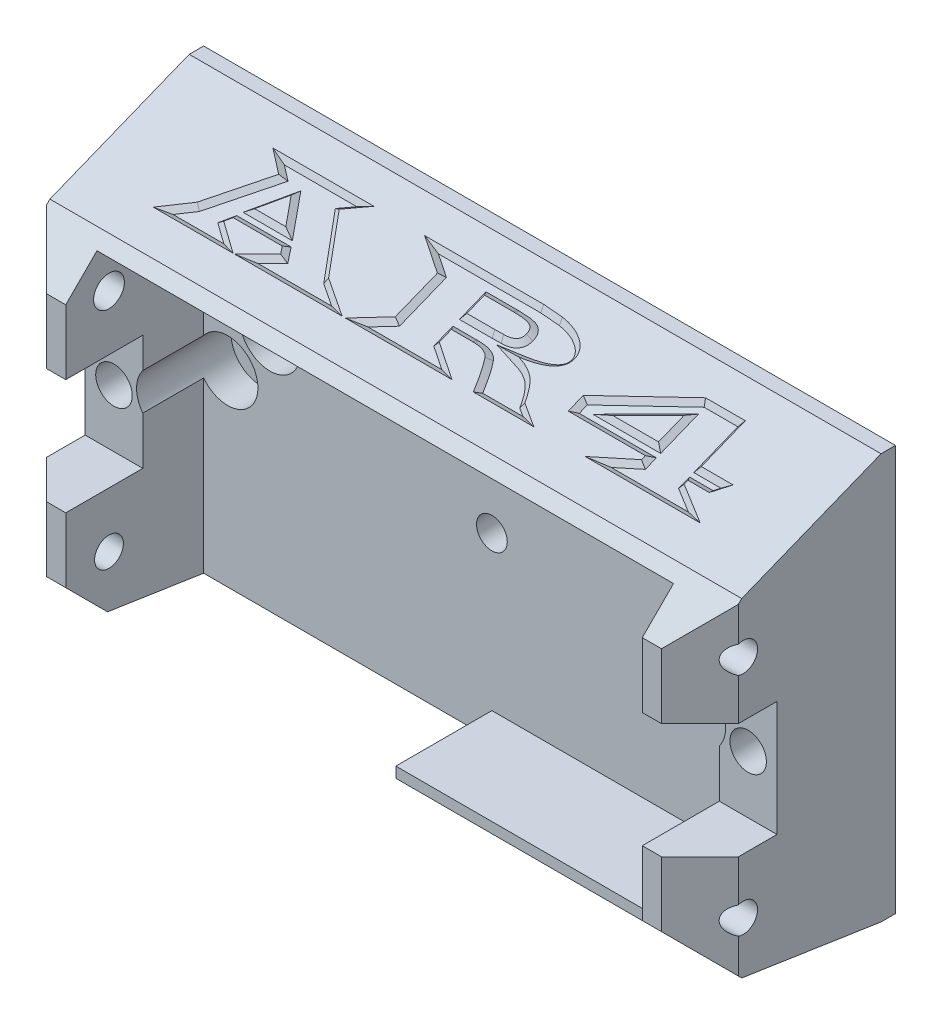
SolidWorks part; units mm, degrees
ref_plane "Front Plane" through (0, 0, 0) normal (0, 0, 1) x (1, 0, 0)
ref_plane "Top Plane" through (0, 0, 0) normal (0, 1, 0) x (1, 0, 0)
ref_plane "Right Plane" through (0, 0, 0) normal (1, 0, 0) x (0, 0, -1)
imported_body "Imported3"
ref_plane "Plane1" through (30, 0, 0) normal (1, 0, 0) x (0, 0, -1)
sketch "Sketch1" plane through (30, 0, 0) normal (1, 0, 0) x (0, 0, -1)
  line L0 (-20.35, 9.85) -> (-6, 9.85)
  line L1 (-6, 9.85) -> (-6, 13.1)
  line L2 (-6, 13.1) -> (-17.1, 13.1)
  line L3 (-17.1, 13.1) -> (-20.35, 9.85)
extrude "Cut-Extrude1" cut sketch "Sketch1" against normal blind 30
sketch "Sketch2" plane through (0, 0, 0) normal (1, 0, 0) x (0, 0, -1)
  line L0 (-20.35, 3.1) -> (-20.35, -8.9)
  line L1 (-20.35, -8.9) -> (-20.35, -19.34)
  line L2 (-20.35, -19.34) -> (-6, -21.5172)
  line L3 (-6, -21.5172) -> (-6, 13.1)
  line L4 (-6, 13.1) -> (-17.1, 13.1)
  line L5 (-17.1, 13.1) -> (-20.35, 9.85)
  line L6 (-20.35, 9.85) -> (-20.35, 3.1)
extrude "Cut-Extrude2" cut sketch "Sketch2" against normal blind 30
sketch "Sketch3" plane through (0, 9.85, 0) normal (0, 1, 0) x (-1, 0, 0)
  line L0 (-30, 20.35) -> (-30, 6)
  line L1 (-30, 6) -> (0, 6)
  line L2 (0, 6) -> (0, 20.35)
  line L3 (0, 20.35) -> (-30, 20.35)
extrude "Cut-Extrude3" cut sketch "Sketch3" against normal blind 6.75
sketch "Sketch4" plane through (0, 3.1, 0) normal (0, 1, 0) x (-1, 0, 0)
  line L0 (0, 20.35) -> (-32, 20.35)
  line L1 (-32, 20.35) -> (-36, 16.35)
  line L2 (-36, 16.35) -> (-36, 12.3321)
  line L3 (-36, 12.3321) -> (-30, 12.3321)
  line L4 (-30, 12.3321) -> (-30, 6)
  line L5 (-30, 6) -> (0, 6)
  line L6 (0, 6) -> (0, 20.35)
extrude "Cut-Extrude4" cut sketch "Sketch4" against normal blind 12
ref_plane "Plane2" through (0, 3.1, 0) normal (0, 1, 0) x (1, 0, 0)
sketch "Sketch5" plane through (0, 3.1, 0) normal (0, 1, 0) x (1, 0, 0)
  line L0 (-30, -12.3321) -> (-36, -12.3321)
  line L1 (-36, -12.3321) -> (-36, -16.35)
  line L2 (-36, -16.35) -> (-32, -20.35)
  line L3 (-32, -20.35) -> (-30, -20.35)
  line L4 (-30, -20.35) -> (-30, -12.3321)
extrude "Cut-Extrude5" cut sketch "Sketch5" against normal blind 12
sketch "Sketch6" plane through (0, 0, 1.5) normal (0, 0, -1) x (-1, 0, 0)
  line L0 (36, -22.2) -> (-36, -22.2)
  line L1 (-36, -22.2) -> (-36, 20)
  line L2 (-36, 20) -> (36, 20)
  line L3 (36, 20) -> (36, -22.2)
extrude "Boss-Extrude1" add sketch "Sketch6" along normal blind 1.5
sketch "Sketch7" plane through (0, -8.9, 0) normal (0, 1, 0) x (-1, 0, 0)
  line L0 (0, 20.35) -> (-30, 20.35)
  line L1 (-30, 20.35) -> (-30, 16)
  line L2 (-30, 16) -> (0, 16)
  line L3 (0, 16) -> (0, 20.35)
extrude "Cut-Extrude6" cut sketch "Sketch7" against normal up to next
sketch "Sketch8" plane through (0, -8.9, 0) normal (0, 1, 0) x (-1, 0, 0)
  line L0 (0, 6) -> (0, 16)
  line L1 (0, 16) -> (-30, 16)
  line L2 (-30, 16) -> (-30, 6)
  line L3 (-30, 6) -> (0, 6)
extrude "Cut-Extrude7" cut sketch "Sketch8" against normal blind 10
sketch "Sketch9" plane through (0, 17.7586, 7.1034) normal (0, 0.9285, 0.3714) x (-1, 0, 0)
  line L0 (-24.7967, -2.8908) -> (-20.6573, -2.8908)
  line L1 (-20.6573, -2.8908) -> (-12.3225, 1.8333)
  line L2 (-12.3225, 1.8333) -> (-12.3225, 3.5315)
  line L3 (-12.3225, 3.5315) -> (-20.3504, 3.5315)
  line L4 (-20.3504, 3.5315) -> (-20.3504, 3.9657)
  line L5 (-20.3504, 3.9657) -> (-16.3712, 6.0016)
  line L6 (-16.3712, 6.0016) -> (-28.3533, 6.0016)
  line L7 (-28.3533, 6.0016) -> (-24.7967, 3.9657)
  line L8 (-24.7967, 3.9657) -> (-24.7967, 3.5315)
  line L9 (-24.7967, 3.5315) -> (-27.0043, 3.5315)
  line L10 (-27.0043, 3.5315) -> (-28.1063, 2.0494)
  line L11 (-28.1063, 2.0494) -> (-24.7967, 2.0494)
  line L12 (-24.7967, 2.0494) -> (-24.7967, -2.8908)
extrude "Cut-Extrude8" cut sketch "Sketch9" against normal blind 0.5 draft 45
sketch "Sketch10" plane through (0, 17.2944, 6.9178) normal (0, 0.9285, 0.3714) x (-1, 0, 0)
  line L0 (-13.794, 2.5494) -> (-20.8504, -1.6947)
  line L1 (-20.8504, -1.6947) -> (-20.8504, 2.5494)
  line L2 (-20.8504, 2.5494) -> (-13.794, 2.5494)
extrude "Boss-Extrude2" add sketch "Sketch10" along normal blind 0.5 draft 45
sketch "Sketch11" plane through (0, 17.7586, 7.1034) normal (0, 0.9285, 0.3714) x (-1, 0, 0)
  line L0 (13.8617, -2.8908) -> (24.3752, -2.8908)
  line L1 (24.3752, -2.8908) -> (22.291, -1.2988)
  line L2 (22.291, -1.2988) -> (25.9499, 3.8943)
  line L3 (25.9499, 3.8943) -> (28.5686, 6.0016)
  line L4 (28.5686, 6.0016) -> (20.2647, 6.0016)
  line L5 (20.2647, 6.0016) -> (22.9472, 4.1529)
  line L6 (22.9472, 4.1529) -> (22.5515, 3.5315)
  line L7 (22.5515, 3.5315) -> (17.4318, 3.5315)
  line L8 (17.4318, 3.5315) -> (17.0285, 4.1529)
  line L9 (17.0285, 4.1529) -> (20.1142, 6.0016)
  line L10 (20.1142, 6.0016) -> (8.9118, 6.0016)
  line L11 (8.9118, 6.0016) -> (12.2735, 3.8943)
  line L12 (12.2735, 3.8943) -> (15.9922, -1.2988)
  line L13 (15.9922, -1.2988) -> (13.8617, -2.8908)
extrude "Cut-Extrude9" cut sketch "Sketch11" against normal blind 0.5 draft 45
sketch "Sketch12" plane through (0, 17.2944, 6.9178) normal (0, 0.9285, 0.3714) x (-1, 0, 0)
  line L0 (17.484, 2.5494) -> (22.609, 2.5494)
  line L1 (22.609, 2.5494) -> (20.1273, -1.2493)
  line L2 (20.1273, -1.2493) -> (17.484, 2.5494)
extrude "Boss-Extrude3" add sketch "Sketch12" along normal blind 0.5 draft 45
sketch "Sketch13" plane through (0, -21.9229, 3.3262) normal (0, -0.9887, 0.15) x (1, 0, 0)
  line L0 (3.9049, 2.1359) -> (6.2298, 2.1359)
  line L1 (6.2298, 2.1359) -> (11.1094, 5.8102)
  line L2 (11.1094, 5.8102) -> (11.1094, 7.131)
  line L3 (11.1094, 7.131) -> (6.4025, 7.131)
  line L4 (6.4025, 7.131) -> (6.4025, 7.4687)
  line L5 (6.4025, 7.4687) -> (8.7349, 9.0522)
  line L6 (8.7349, 9.0522) -> (1.8561, 9.0522)
  line L7 (1.8561, 9.0522) -> (3.9049, 7.4687)
  line L8 (3.9049, 7.4687) -> (3.9049, 7.131)
  line L9 (3.9049, 7.131) -> (2.6321, 7.131)
  line L10 (2.6321, 7.131) -> (1.9987, 5.9783)
  line L11 (1.9987, 5.9783) -> (3.9049, 5.9783)
  line L12 (3.9049, 5.9783) -> (3.9049, 2.1359)
extrude "Cut-Extrude10" cut sketch "Sketch13" against normal blind 0.5 draft 45
ref_plane "Plane3" through (0, -21.9229, 3.3262) normal (0, -0.9887, 0.15) x (1, 0, 0)
sketch "Sketch14" plane through (0, -21.9229, 3.3262) normal (0, -0.9887, 0.15) x (1, 0, 0)
  line L0 (9.1912, 5.9783) -> (6.4025, 5.9783)
  line L1 (6.4025, 5.9783) -> (6.4025, 3.7539)
  line L2 (6.4025, 3.7539) -> (9.1912, 5.9783)
extrude "Boss-Extrude4" add sketch "Sketch14" against normal up to next draft 45
sketch "Sketch15" plane through (0, -21.9229, 3.3262) normal (0, -0.9887, 0.15) x (1, 0, 0)
  line L0 (25.883, 2.1359) -> (31.9393, 2.1359)
  line L1 (31.9393, 2.1359) -> (30.7385, 3.3741)
  line L2 (30.7385, 3.3741) -> (32.8474, 7.4132)
  line L3 (32.8474, 7.4132) -> (34.3558, 9.0522)
  line L4 (34.3558, 9.0522) -> (29.5723, 9.0522)
  line L5 (29.5723, 9.0522) -> (31.1183, 7.6143)
  line L6 (31.1183, 7.6143) -> (30.8886, 7.131)
  line L7 (30.8886, 7.131) -> (27.9393, 7.131)
  line L8 (27.9393, 7.131) -> (27.7066, 7.6143)
  line L9 (27.7066, 7.6143) -> (29.4853, 9.0522)
  line L10 (29.4853, 9.0522) -> (23.0312, 9.0522)
  line L11 (23.0312, 9.0522) -> (24.9674, 7.4132)
  line L12 (24.9674, 7.4132) -> (27.1108, 3.3741)
  line L13 (27.1108, 3.3741) -> (25.883, 2.1359)
extrude "Cut-Extrude11" cut sketch "Sketch15" against normal blind 0.5 draft 45
sketch "Sketch16" plane through (0, -21.4286, 3.2512) normal (0, -0.9887, 0.15) x (1, 0, 0)
  line L0 (27.7016, 6.4783) -> (31.1878, 6.4783)
  line L1 (31.1878, 6.4783) -> (29.4993, 2.9893)
  line L2 (29.4993, 2.9893) -> (27.7016, 6.4783)
extrude "Boss-Extrude5" add sketch "Sketch16" along normal blind 0.5 draft 45
sketch "Sketch17" plane through (0, 0, 6) normal (0, 0, 1) x (1, 0, 0)
  arc A0 (-22.1363, 6.3005) -> (-24.0572, 6.2995) centre (-23.0985, 9.3) ccw
  arc A1 (-24.0572, 6.2995) -> (-22.1363, 6.3005) centre (-23.0951, 3.3) ccw
extrude "Cut-Extrude12" cut sketch "Sketch17" against normal blind 3.5
sketch "Sketch18" plane through (0, 0, 6) normal (0, 0, 1) x (1, 0, 0)
  arc A0 (24.0492, 6.1) -> (22.1282, 6.1) centre (23.0887, 9.1) ccw
  arc A1 (22.1282, 6.1) -> (24.0492, 6.1) centre (23.0887, 3.1) ccw
extrude "Cut-Extrude13" cut sketch "Sketch18" against normal blind 3.5
ref_plane "Plane4" through (0, 0, 15.85) normal (0, 0, 1) x (1, 0, 0)
sketch "Sketch19" plane through (0, 0, 15.85) normal (0, 0, 1) x (1, 0, 0)
  line L0 (-36, 10.45) -> (-36, 8.85)
  line L1 (-36, 8.85) -> (-30, 8.85)
  line L2 (-30, 8.85) -> (-30, 10.45)
  line L3 (-30, 10.45) -> (-36, 10.45)
  line L4 (-36, 8.85) -> (-30, 8.85) construction
  dimension "D1" = 1.6
revolve "Cut-Revolve1" cut sketch "Sketch19" angle 360 about L4
sketch "Sketch20" plane through (0, 0, 15.85) normal (0, 0, 1) x (1, 0, 0)
  line L0 (30, -13.15) -> (30, -14.65)
  line L1 (30, -14.65) -> (36, -14.65)
  line L2 (36, -14.65) -> (36, -13.15)
  line L3 (36, -13.15) -> (30, -13.15)
  line L4 (30, -14.65) -> (36, -14.65) construction
revolve "Cut-Revolve2" cut sketch "Sketch20" angle 360 about L4
ref_plane "Plane5" through (0, -2, 0) normal (0, 1, 0) x (1, 0, 0)
sketch "Sketch21" plane through (0, -2, 0) normal (0, 1, 0) x (1, 0, 0)
  line L0 (-25.75, 0) -> (-27.5, 0)
  line L1 (-27.5, 0) -> (-27.5, -12.3321)
  line L2 (-27.5, -12.3321) -> (-24.35, -12.3321)
  line L3 (-24.35, -12.3321) -> (-24.35, -2.5)
  line L4 (-24.35, -2.5) -> (-25.75, -2.5)
  line L5 (-25.75, -2.5) -> (-25.75, 0)
  line L6 (-27.5, 0) -> (-27.5, -12.3321) construction
revolve "Cut-Revolve3" cut sketch "Sketch21" angle 360 about L6
sketch "Sketch22" plane through (0, -2, 0) normal (0, 1, 0) x (1, 0, 0)
  line L0 (29.25, 0) -> (27.5, 0)
  line L1 (27.5, 0) -> (27.5, -12.3321)
  line L2 (27.5, -12.3321) -> (30.65, -12.3321)
  line L3 (30.65, -12.3321) -> (30.65, -2.5)
  line L4 (30.65, -2.5) -> (29.25, -2.5)
  line L5 (29.25, -2.5) -> (29.25, 0)
  line L6 (27.5, 0) -> (27.5, -12.3321) construction
revolve "Cut-Revolve4" cut sketch "Sketch22" angle 360 about L6
chamfer "Chamfer1" distance 4.3998 angle 36.373 1 edges at (31, -19.34, 20.35)
chamfer "Chamfer2" distance 3.69 angle 45 1 edges at (-31, -19.34, 20.35)
sketch "Sketch33" plane through (0, 0, 6) normal (0, 0, 1) x (1, 0, 0)
  line L1 (36, -22.2) -> (-36, -22.2) construction
  line L2 (36, 20) -> (36, -22.2) construction
  circle A0 centre (0, -2.9) radius 1.6
  dimension "D3" = 3.2
  dimension "D1" = 19.3
  dimension "D2" = 36
extrude "Cut-Extrude14" cut sketch "Sketch33" against normal through all both and the other way through all
sketch "Sketch34" plane through (0, 0, 2.5) normal (0, 0, 1) x (1, 0, 0)
  line L0 (-30, 13.1) -> (30, 13.1) construction
  line L1 (-30, -0.0836) -> (-30, 13.1) construction
  circle A0 centre (-23.0986, 9.5) radius 1.75
  circle A2 centre (-23.0949, 3) radius 1.75
  dimension "D1" = 3.5
  dimension "D2" = 3.6
  dimension "D3" = 6.9014
  dimension "D4" = 6.5
  dimension "D5" = 6.9051
extrude "Cut-Extrude15" cut sketch "Sketch34" against normal through all both and the other way through all
mirror "Mirror1" about plane through (0, 0, 0) normal (1, 0, 0) of "Cut-Extrude15"
sketch "Sketch35" plane through (30, 0, 0) normal (-1, 0, 0) x (0, 0, 1)
  line L0 (20.35, -15.65) -> (20.35, -8.9) construction
  line L1 (16, -18.9) -> (6, -18.9) construction
  circle A0 centre (15.85, -14.65) radius 1.5
  dimension "D3" = 3
  dimension "D1" = 4.5
  dimension "D2" = 4.25
extrude "Cut-Extrude16" cut sketch "Sketch35" against normal through all both and the other way through all
ref_plane "Plane6" through (0, -2.9, 0) normal (0, -1, 0) x (-1, 0, 0)
mirror "Mirror2" about plane through (0, -2.9, 0) normal (0, -1, 0) of "Cut-Extrude16"
sketch "Sketch36" plane through (0, 0, 12.3321) normal (0, 0, 1) x (1, 0, 0)
  line L0 (-30, 3.1) -> (-36, 3.1) construction
  line L1 (-36, -8.9) -> (-36, 3.1) construction
  circle A0 centre (-33, -2.9) radius 1.9
  dimension "D3" = 3.8
  dimension "D1" = 6
  dimension "D2" = 3
extrude "Cut-Extrude17" cut sketch "Sketch36" against normal blind 7
mirror "Mirror3" about plane through (0, 0, 0) normal (1, 0, 0) of "Cut-Extrude17"
